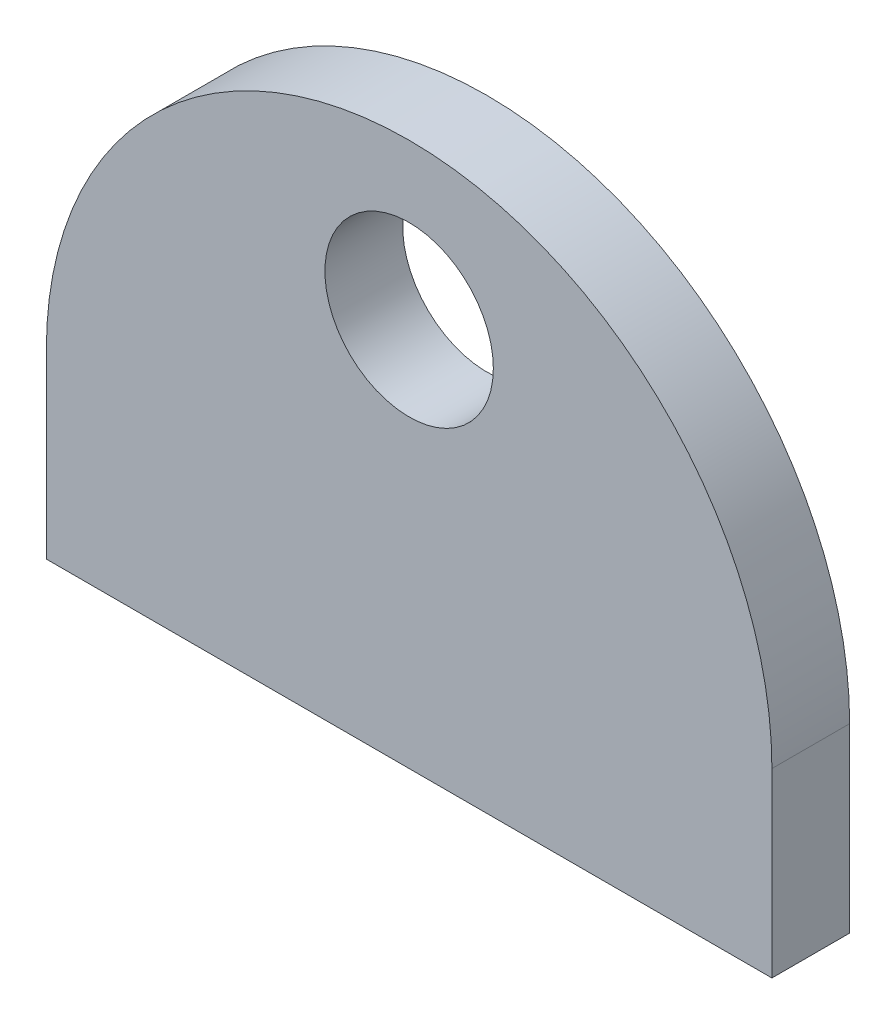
SolidWorks part; units mm, degrees
ref_plane "Plan1" through (0, 0, 0) normal (0, 0, 1) x (1, 0, 0)
ref_plane "Plan2" through (0, 0, 0) normal (0, 1, 0) x (1, 0, 0)
ref_plane "Plan3" through (0, 0, 0) normal (1, 0, 0) x (0, 0, -1)
sketch "Esquisse1" plane through (0, 0, 0) normal (0, 0, 1) x (1, 0, 0)
  line L1 (14, -8) -> (14, -15)
  line L2 (-14, -15) -> (14, -15)
  line L3 (-14, -15) -> (-14, -8)
  arc A0 (14, -8) -> (-14, -8) centre (0, -8) ccw
  circle A2 centre (0, 0) radius 3.25
  dimension "D1" = 14
  dimension "D4" = 6.5
  dimension "D2" = 7
  dimension "D5" = 15
  dimension "D6" = 28
  dimension "D7" = 14
extrude "Base-Extrusion" add sketch "Esquisse1" along normal blind 3
